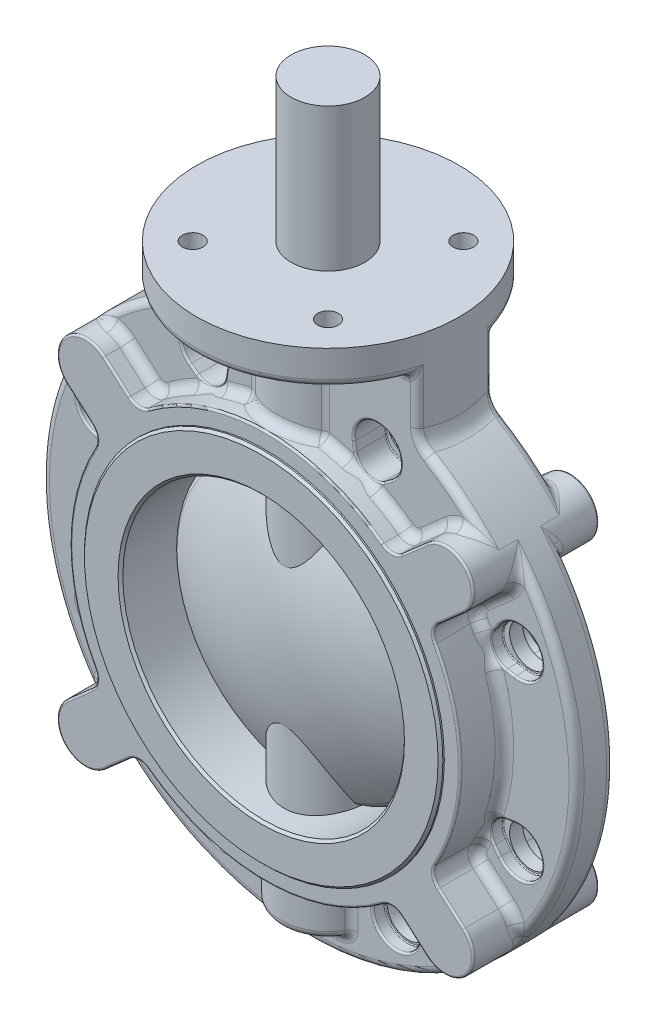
SolidWorks part; units mm, degrees
ref_plane "Front Plane" through (0, 0, 0) normal (0, 0, 1) x (1, 0, 0)
ref_plane "Top Plane" through (0, 0, 0) normal (0, 1, 0) x (1, 0, 0)
ref_plane "Right Plane" through (0, 0, 0) normal (1, 0, 0) x (0, 0, -1)
sketch "Sketch1" plane through (0, 0, 0) normal (0, 0, 1) x (1, 0, 0)
  circle A0 centre (0, 0) radius 142.5
  circle A1 centre (0, 0) radius 92.71
  dimension "D1" = 285
  dimension "D2" = 185.42
extrude "BODY" add sketch "Sketch1" along normal mid plane 67
sketch "Sketch2" plane through (0, 0, 33.5) normal (0, 0, 1) x (1, 0, 0)
  line L0 (0, 0) -> (166.3467, 0) construction
  line L1 (0, 0) -> (126.8644, 111.2571) construction
  line L2 (0, 0) -> (125.9507, -110.4558) construction
  line L3 (0, 0) -> (0, 156.1227) construction
  line L4 (72.5212, 83.5504) -> (85.9694, 95.3442)
  line L5 (105.7498, 72.789) -> (92.3016, 60.9952)
  line L6 (105.7498, -72.789) -> (92.3016, -60.9952)
  line L7 (72.5212, -83.5504) -> (85.9694, -95.3442)
  line L8 (-105.7498, -72.789) -> (-92.3016, -60.9952)
  line L9 (-72.5212, -83.5504) -> (-85.9694, -95.3442)
  line L10 (-105.7498, 72.789) -> (-92.3016, 60.9952)
  line L11 (-72.5212, 83.5504) -> (-85.9694, 95.3442)
  arc A0 (62.4431, 83.1676) -> (-62.4431, 83.1676) centre (0, 0) ccw
  arc A1 (105.7498, 72.789) -> (85.9694, 95.3442) centre (95.8596, 84.0666) ccw
  arc A3 (90.6066, 51.0533) -> (92.3016, 60.9952) centre (97.5763, 54.9805) cw
  arc A4 (72.5212, 83.5504) -> (62.4431, 83.1676) centre (67.2464, 89.5652) cw
  arc A5 (90.6066, -51.0533) -> (92.3016, -60.9952) centre (97.5763, -54.9805) ccw
  arc A6 (105.7498, -72.789) -> (85.9694, -95.3442) centre (95.8596, -84.0666) cw
  arc A7 (72.5212, -83.5504) -> (62.4431, -83.1676) centre (67.2464, -89.5652) ccw
  arc A8 (-90.6066, -51.0533) -> (-92.3016, -60.9952) centre (-97.5763, -54.9805) cw
  arc A9 (-72.5212, -83.5504) -> (-62.4431, -83.1676) centre (-67.2464, -89.5652) cw
  arc A10 (-105.7498, -72.789) -> (-85.9694, -95.3442) centre (-95.8596, -84.0666) ccw
  arc A11 (-90.6066, 51.0533) -> (-92.3016, 60.9952) centre (-97.5763, 54.9805) ccw
  arc A12 (-105.7498, 72.789) -> (-85.9694, 95.3442) centre (-95.8596, 84.0666) cw
  arc A13 (-72.5212, 83.5504) -> (-62.4431, 83.1676) centre (-67.2464, 89.5652) ccw
  arc A14 (-90.6066, 51.0533) -> (-90.6066, -51.0533) centre (0, 0) ccw
  arc A15 (90.6066, -51.0533) -> (90.6066, 51.0533) centre (0, 0) ccw
  arc A16 (-62.4431, -83.1676) -> (62.4431, -83.1676) centre (0, 0) ccw
  dimension "D2" = 208
  dimension "D3" = 30
  dimension "D6" = 8
  dimension "D1" = 82.5
  dimension "D4" = 127.5
  dimension "D5" = 30
extrude "FACE PROFILE SHALLOW" cut sketch "Sketch2" against normal blind 13.5 flip side to cut
sketch "Sketch3" plane through (0, 0, 20) normal (0, 0, 1) x (1, 0, 0)
  line L0 (-105.7498, 72.789) -> (-92.3016, 60.9952) construction
  line L1 (-92.3016, -60.9952) -> (-105.7498, -72.789) construction
  line L2 (92.3016, 60.9952) -> (105.7498, 72.789) construction
  line L3 (105.7498, -72.789) -> (92.3016, -60.9952) construction
  line L4 (72.5212, -83.5504) -> (85.9694, -95.3442) construction
  line L5 (-85.9694, -95.3442) -> (-72.5212, -83.5504) construction
  line L6 (-105.7498, 72.789) -> (-92.3016, 60.9952)
  line L7 (-92.3016, -60.9952) -> (-105.7498, -72.789)
  line L8 (92.3016, 60.9952) -> (105.7498, 72.789)
  line L9 (105.7498, -72.789) -> (92.3016, -60.9952)
  line L10 (72.5212, -83.5504) -> (85.9694, -95.3442)
  line L11 (-85.9694, -95.3442) -> (-72.5212, -83.5504)
  line L12 (-107.1372, 93.9568) -> (-123.1493, 107.999)
  line L13 (107.1372, 93.9568) -> (121.2847, 110.0889)
  arc A1 (-85.9694, 95.3442) -> (-105.7498, 72.789) centre (-95.8596, 84.0666) ccw construction
  arc A2 (-90.6066, 51.0533) -> (-92.3016, 60.9952) centre (-97.5763, 54.9805) ccw construction
  arc A3 (-90.6066, 51.0533) -> (-90.6066, -51.0533) centre (0, 0) ccw construction
  arc A4 (-92.3016, -60.9952) -> (-90.6066, -51.0533) centre (-97.5763, -54.9805) ccw construction
  arc A6 (105.7498, 72.789) -> (85.9694, 95.3442) centre (95.8596, 84.0666) ccw construction
  arc A7 (92.3016, 60.9952) -> (90.6066, 51.0533) centre (97.5763, 54.9805) ccw construction
  arc A8 (90.6066, -51.0533) -> (90.6066, 51.0533) centre (0, 0) ccw construction
  arc A9 (90.6066, -51.0533) -> (92.3016, -60.9952) centre (97.5763, -54.9805) ccw construction
  arc A11 (85.9694, -95.3442) -> (105.7498, -72.789) centre (95.8596, -84.0666) ccw construction
  arc A12 (72.5212, -83.5504) -> (62.4431, -83.1676) centre (67.2464, -89.5652) ccw construction
  arc A13 (-105.7498, -72.789) -> (-85.9694, -95.3442) centre (-95.8596, -84.0666) ccw construction
  arc A14 (-62.4431, -83.1676) -> (-72.5212, -83.5504) centre (-67.2464, -89.5652) ccw construction
  arc A15 (-62.4431, -83.1676) -> (62.4431, -83.1676) centre (0, 0) ccw construction
  arc A16 (-123.1493, 107.999) -> (121.2847, 110.0889) centre (0, 0) ccw
  arc A17 (-107.1372, 93.9568) -> (-105.7498, 72.789) centre (-95.8596, 84.0666) ccw
  arc A18 (-90.6066, 51.0533) -> (-92.3016, 60.9952) centre (-97.5763, 54.9805) ccw
  arc A19 (-90.6066, 51.0533) -> (-90.6066, -51.0533) centre (0, 0) ccw
  arc A20 (-92.3016, -60.9952) -> (-90.6066, -51.0533) centre (-97.5763, -54.9805) ccw
  arc A22 (105.7498, 72.789) -> (107.1372, 93.9568) centre (95.8596, 84.0666) ccw
  arc A23 (92.3016, 60.9952) -> (90.6066, 51.0533) centre (97.5763, 54.9805) ccw
  arc A24 (90.6066, -51.0533) -> (90.6066, 51.0533) centre (0, 0) ccw
  arc A25 (90.6066, -51.0533) -> (92.3016, -60.9952) centre (97.5763, -54.9805) ccw
  arc A27 (85.9694, -95.3442) -> (105.7498, -72.789) centre (95.8596, -84.0666) ccw
  arc A28 (72.5212, -83.5504) -> (62.4431, -83.1676) centre (67.2464, -89.5652) ccw
  arc A29 (-105.7498, -72.789) -> (-85.9694, -95.3442) centre (-95.8596, -84.0666) ccw
  arc A30 (-62.4431, -83.1676) -> (-72.5212, -83.5504) centre (-67.2464, -89.5652) ccw
  arc A31 (-62.4431, -83.1676) -> (62.4431, -83.1676) centre (0, 0) ccw
extrude "FACE PROFILE DEEP" cut sketch "Sketch3" against normal blind 10
mirror "FACE PROFILES Mirror" about plane through (0, 0, 0) normal (0, 0, 1) of "FACE PROFILE SHALLOW", "FACE PROFILE DEEP"
fillet "PROFILE FILLETS EDGE" radius 1 50 edges at (107.1372, -93.9568, -33.5) (-107.1372, -93.9568, -33.5) (-107.1372, 93.9568, -33.5) (107.1372, 93.9568, -33.5) (79.2453, 89.4473, -33.5) (67.5501, 81.5709, -33.5) (0, 104, -33.5) (-67.5501, 81.5709, -33.5) (-79.2453, 89.4473, -33.5) (99.0257, -66.8921, -33.5) (89.6901, -56.325, -33.5) (104, 0, -33.5) (89.6901, 56.325, -33.5) (99.0257, 66.8921, -33.5) (-79.2453, -89.4473, -33.5) (-67.5501, -81.5709, -33.5) (0, -104, -33.5) (67.5501, -81.5709, -33.5) (79.2453, -89.4473, -33.5) (-99.0257, 66.8921, -33.5) (-89.6901, 56.325, -33.5) (-104, 0, -33.5) (-89.6901, -56.325, -33.5) (-99.0257, -66.8921, -33.5) (107.1372, -93.9568, 33.5) (-107.1372, -93.9568, 33.5) (-107.1372, 93.9568, 33.5) (107.1372, 93.9568, 33.5) (104, 0, 33.5) (89.6901, -56.325, 33.5) (99.0257, -66.8921, 33.5) (79.2453, -89.4473, 33.5) (67.5501, -81.5709, 33.5) (0, -104, 33.5) (-67.5501, -81.5709, 33.5) (-79.2453, -89.4473, 33.5) (-99.0257, -66.8921, 33.5) (-89.6901, -56.325, 33.5) (-104, 0, 33.5) (-89.6901, 56.325, 33.5) (-99.0257, 66.8921, 33.5) (-79.2453, 89.4473, 33.5) (-67.5501, 81.5709, 33.5) (0, 104, 33.5) (67.5501, 81.5709, 33.5) (79.2453, 89.4473, 33.5) (99.0257, 66.8921, 33.5) (89.6901, 56.325, 33.5) (92.71, 0, -33.5) (92.71, 0, 33.5)
ref_plane "BOT DIA PLANE" through (0, -130, 0) normal (0, 1, 0) x (-1, 0, 0)
sketch "Sketch4" plane through (0, -130, 0) normal (0, 1, 0) x (-1, 0, 0)
  circle A0 centre (0, 0) radius 25
  dimension "D1" = 50
extrude "BOT DIA" add sketch "Sketch4" along normal up to next
fillet "BOT DIA FILLET LARGE" radius 4 2 edges at (0, -130, -25) (0, -130, 25)
ref_plane "TOP OF VALVE" through (0, 175, 0) normal (0, 1, 0) x (-1, 0, 0)
sketch "Sketch5" plane through (0, 175, 0) normal (0, 1, 0) x (-1, 0, 0)
  circle A0 centre (0, 0) radius 70
  dimension "D1" = 140
extrude "TOP DIA" add sketch "Sketch5" against normal blind 18.5
ref_plane "BOT PLANE VALVE TOP" through (0, 156.5, 0) normal (0, 1, 0) x (-1, 0, 0)
sketch "Sketch6" plane through (0, 156.5, 0) normal (0, 1, 0) x (-1, 0, 0)
  line L0 (107.1372, 20) -> (-107.1372, 20) construction
  line L1 (-107.1372, -20) -> (107.1372, -20) construction
  line L2 (67.082, 20) -> (-67.082, 20)
  line L3 (-67.082, -20) -> (67.082, -20)
  circle A0 centre (0, 0) radius 70 construction
  arc A1 (67.082, -20) -> (67.082, 20) centre (0, 0) ccw
  arc A2 (-67.082, 20) -> (-67.082, -20) centre (0, 0) ccw
extrude "TOP VERT BODY" add sketch "Sketch6" against normal up to surface (30.7771 mm away)
fillet "TOP VERT FILLETS SIDE" radius 10 2 edges at (69.9965, 124.1239, -0.7041) (-69.9965, 124.1239, 0.7041)
fillet "PROFILE FILLETS PERIMETER" radius 4 20 edges at (142.5, 0, 10) (0, -142.5, 10) (-142.5, 0, 10) (69.5859, 125.1073, 20) (90.9059, 109.7377, 20) (-69.3463, 125.4011, 20) (-90.9059, 109.7377, 20) (-69.5859, 125.1073, -20) (69.3463, 125.4011, -20) (-90.9059, 109.7377, -20) (-142.5, 0, -10) (0, -142.5, -10) (142.5, 0, -10) (90.9059, 109.7377, -20)
sketch "Sketch9" plane through (0, 175, 0) normal (0, 1, 0) x (-1, 0, 0)
  line L0 (0, 0) -> (0, -74.4103) construction
  line L1 (0, -6) -> (0, -16) construction
  line L2 (0, 0) -> (-151.174, 0) construction
  line L3 (0, 0) -> (-58.612, -58.612) construction
  circle A0 centre (0, 0) radius 51 construction
  circle A1 centre (-36.0624, -36.0624) radius 5.5
  circle A2 centre (36.0624, -36.0624) radius 5.5
  circle A3 centre (-36.0624, 36.0624) radius 5.5
  circle A4 centre (36.0624, 36.0624) radius 5.5
  dimension "D2" = 102
  dimension "D3" = 11
  dimension "D1" = 45
extrude "TOP DIA 4 THRU HOLES" cut sketch "Sketch9" against normal blind 18.5
sketch "Sketch10" plane through (0, 156.5, 0) normal (0, 1, 0) x (-1, 0, 0)
  circle A0 centre (0, 0) radius 27.5
  dimension "D1" = 55
extrude "TOP VERT DIA" add sketch "Sketch10" against normal up to next
sketch "Sketch11" plane through (0, 0, 0) normal (1, 0, 0) x (0, 0, -1)
  line L1 (-66, 156.5) -> (-20, 156.5) construction
  line L2 (-20.5085, 141.5) -> (-20.5085, 156.5)
  line L3 (-50, 156.5) -> (-20.5085, 156.5)
  line L4 (-50, 156.5) -> (-20.5085, 141.5)
  line L5 (0, 114.9675) -> (0, 155.7847) construction
  dimension "D1" = 50
  dimension "D2" = 15
extrude "TOP GUSSET" add sketch "Sketch11" along normal mid plane 14
mirror "TOP GUSSET Mirror" about plane through (0, 0, 0) normal (0, 0, 1) of "TOP GUSSET"
sketch "Sketch14" plane through (0, 0, 0) normal (0, 0, 1) x (1, 0, 0)
  line L0 (0, 0) -> (-155.764, 0) construction
  line L1 (0, 0) -> (0, 187.0979) construction
  line L2 (0, 0) -> (-141.1825, 58.4797) construction
  circle A0 centre (-111.4661, 46.1708) radius 11.176
  circle A1 centre (0, 0) radius 120.65 construction
  circle A2 centre (-46.1708, 111.4661) radius 11.176
  circle A3 centre (46.1708, 111.4661) radius 11.176
  circle A4 centre (111.4661, 46.1708) radius 11.176
  circle A5 centre (111.4661, -46.1708) radius 11.176
  circle A6 centre (46.1708, -111.4661) radius 11.176
  circle A7 centre (-46.1708, -111.4661) radius 11.176
  circle A8 centre (-111.4661, -46.1708) radius 11.176
  dimension "D3" = 241.3
  dimension "D2" = 22.352
  dimension "D1" = 22.5
extrude "THRU HOLE FOR LUGS" cut sketch "Sketch14" against normal through all and the other way through all
sketch "Sketch15" plane through (0, 0, 20) normal (0, 0, 1) x (1, 0, 0)
  line L0 (-46.1708, 111.4661) -> (0, 0) construction
  line L1 (-53.5653, 101.4523) -> (-49.5994, 98.5655)
  line L2 (53.5653, 101.4523) -> (49.5994, 98.5655)
  line L3 (-33.8612, 109.614) -> (-34.6242, 104.7684)
  line L4 (33.8612, 109.614) -> (34.6242, 104.7684)
  line L5 (109.614, 33.8612) -> (104.7684, 34.6242)
  line L6 (101.4523, 53.5653) -> (98.5655, 49.5994)
  line L7 (101.4523, -53.5653) -> (98.5655, -49.5994)
  line L8 (109.614, -33.8612) -> (104.7684, -34.6242)
  line L9 (33.8612, -109.614) -> (34.6242, -104.7684)
  line L10 (53.5653, -101.4523) -> (49.5994, -98.5655)
  line L11 (-53.5653, -101.4523) -> (-49.5994, -98.5655)
  line L12 (-33.8612, -109.614) -> (-34.6242, -104.7684)
  line L13 (-109.614, -33.8612) -> (-104.7684, -34.6242)
  line L14 (-101.4523, -53.5653) -> (-98.5655, -49.5994)
  line L15 (-101.4523, 53.5653) -> (-98.5655, 49.5994)
  line L16 (-109.614, 33.8612) -> (-104.7684, 34.6242)
  line L17 (0, 0) -> (-215.4838, 0) construction
  arc A1 (-33.8612, 109.614) -> (-53.5653, 101.4523) centre (-46.209, 111.5585) ccw
  arc A2 (-49.5994, 98.5655) -> (-34.6242, 104.7684) centre (-44.0086, 106.2461) ccw
  arc A3 (53.5653, 101.4523) -> (33.8612, 109.614) centre (46.209, 111.5585) ccw
  arc A4 (34.6242, 104.7684) -> (49.5994, 98.5655) centre (44.0086, 106.2461) ccw
  arc A5 (109.614, 33.8612) -> (101.4523, 53.5653) centre (111.5585, 46.209) ccw
  arc A6 (98.5655, 49.5994) -> (104.7684, 34.6242) centre (106.2461, 44.0086) ccw
  arc A7 (101.4523, -53.5653) -> (109.614, -33.8612) centre (111.5585, -46.209) ccw
  arc A8 (104.7684, -34.6242) -> (98.5655, -49.5994) centre (106.2461, -44.0086) ccw
  arc A9 (33.8612, -109.614) -> (53.5653, -101.4523) centre (46.209, -111.5585) ccw
  arc A10 (49.5994, -98.5655) -> (34.6242, -104.7684) centre (44.0086, -106.2461) ccw
  arc A11 (-53.5653, -101.4523) -> (-33.8612, -109.614) centre (-46.209, -111.5585) ccw
  arc A12 (-34.6242, -104.7684) -> (-49.5994, -98.5655) centre (-44.0086, -106.2461) ccw
  arc A13 (-109.614, -33.8612) -> (-101.4523, -53.5653) centre (-111.5585, -46.209) ccw
  arc A14 (-98.5655, -49.5994) -> (-104.7684, -34.6242) centre (-106.2461, -44.0086) ccw
  arc A15 (-101.4523, 53.5653) -> (-109.614, 33.8612) centre (-111.5585, 46.209) ccw
  arc A16 (-104.7684, 34.6242) -> (-98.5655, 49.5994) centre (-106.2461, 44.0086) ccw
  dimension "D1" = 25
  dimension "D3" = 19
  dimension "D2" = 120.75
  dimension "D4" = 115
extrude "LUG INSERTS PROFILE" cut sketch "Sketch15" against normal blind 16.5
mirror "LUG INSERTS PROFILE Mirror" about plane through (0, 0, 0) normal (0, 0, 1) of "LUG INSERTS PROFILE"
fillet "LUG INSERTS PROFILE FILLETS" radius 1 64 edges at (-34.2427, 107.1912, 20) (-50.9926, 123.1069, 20) (-51.5824, 100.0089, 20) (-40.3731, 97.4693, 20) (-100.0089, 51.5824, 10) (-97.4693, 40.3731, 10) (-107.1912, 34.2427, 10) (-107.1912, -34.2427, 10) (-97.4693, -40.3731, 10) (-100.0089, -51.5824, 10) (-51.5824, -100.0089, 10) (-40.3731, -97.4693, 10) (-34.2427, -107.1912, 10) (50.9926, -123.1069, 10) (34.2427, -107.1912, 10) (40.3731, -97.4693, 10) (107.1912, -34.2427, 10) (123.1069, -50.9926, 10) (100.0089, -51.5824, 10) (100.0089, 51.5824, 10) (123.1069, 50.9926, 10) (107.1912, 34.2427, 10) (51.5824, 100.0089, 20) (40.3731, 97.4693, 20) (-123.1069, 50.9926, 10) (-123.1069, -50.9926, 10) (-50.9926, -123.1069, 10) (51.5824, -100.0089, 10) (97.4693, -40.3731, 10) (97.4693, 40.3731, 10) (50.9926, 123.1069, 20) (34.2427, 107.1912, 20) (107.1912, 34.2427, -10) (97.4693, 40.3731, -10) (100.0089, 51.5824, -10) (123.1069, 50.9926, -10) (51.5824, 100.0089, -20) (40.3731, 97.4693, -20) (34.2427, 107.1912, -20) (50.9926, 123.1069, -20) (-51.5824, 100.0089, -20) (-50.9926, 123.1069, -20) (-34.2427, 107.1912, -20) (-40.3731, 97.4693, -20) (-107.1912, -34.2427, -10) (-97.4693, -40.3731, -10) (-100.0089, -51.5824, -10) (-100.0089, 51.5824, -10) (-97.4693, 40.3731, -10) (-107.1912, 34.2427, -10) (-123.1069, -50.9926, -10) (-123.1069, 50.9926, -10) (-51.5824, -100.0089, -10) (-40.3731, -97.4693, -10) (-34.2427, -107.1912, -10) (34.2427, -107.1912, -10) (40.3731, -97.4693, -10) (51.5824, -100.0089, -10) (100.0089, -51.5824, -10) (97.4693, -40.3731, -10) (107.1912, -34.2427, -10) (-50.9926, -123.1069, -10) (50.9926, -123.1069, -10) (123.1069, -50.9926, -10)
fillet "PROFILE FILLETS LARGE" radius 5 106 edges at (-91.0283, -98.2673, 10) (109.3081, -77.4231, 10) (-109.3081, 77.4231, 10) (-99.0257, 66.8921, 10) (-89.6901, 56.325, 10) (-104, 0, 10) (-89.6901, -56.325, 10) (-99.0257, -66.8921, 10) (-110.0668, -88.8785, 10) (-79.2453, -89.4473, 10) (-67.5501, -81.5709, 10) (43.6454, -94.3985, 10) (67.5501, -81.5709, 10) (79.2453, -89.4473, 10) (102.4847, -97.5242, 10) (99.0257, -66.8921, 10) (89.6901, -56.325, 10) (104, 0, 10) (89.6901, 56.325, 10) (99.0257, 66.8921, 10) (-91.0283, 98.2673, -20) (79.2453, 89.4473, -20) (67.5501, 81.5709, -20) (41.766, 95.245, -20) (-67.5501, 81.5709, -20) (-79.2453, 89.4473, -20) (99.0257, 66.8921, -10) (89.6901, 56.325, -10) (79.2453, 89.4473, 20) (104, 0, -10) (89.6901, -56.325, -10) (99.0257, -66.8921, -10) (109.3081, -77.4231, -10) (102.4847, -97.5242, -10) (79.2453, -89.4473, -10) (67.5501, -81.5709, -10) (43.6454, -94.3985, -10) (-67.5501, -81.5709, -10) (-79.2453, -89.4473, -10) (67.5501, 81.5709, 20) (-91.0283, -98.2673, -10) (-110.0668, -88.8785, -10) (-99.0257, -66.8921, -10) (-89.6901, -56.325, -10) (-104, 0, -10) (-89.6901, 56.325, -10) (-99.0257, 66.8921, -10) (-109.3081, 77.4231, -10) (41.766, 95.245, 20) (-67.5501, 81.5709, 20) (-79.2453, 89.4473, 20) (-91.0283, 98.2673, 20) (-43.6454, -94.3985, -10) (-3.3247, -103.9468, 24.7779) (22.9129, -113.7223, -10) (-43.6454, -94.3985, 10) (3.3247, -103.9468, 24.7779) (-22.9129, -113.7223, 10) (-22.9129, -113.7223, -10) (0, -130, -10) (22.9129, -113.7223, 10) (0, -130, 10) (-22.089, -128.3358, -10) (21.5291, -128.9159, -10) (22.089, -128.3358, 10) (-21.5291, -128.9159, 10) (91.0283, 98.2673, -20) (-109.3081, -77.4231, -10) (91.0283, -98.2673, -10) (-102.4847, -97.5242, -10) (110.0668, -88.8785, -10) (109.3081, 77.4231, -10) (91.0283, 98.2673, 20) (109.3081, 77.4231, 10) (110.0668, -88.8785, 10) (-102.4847, -97.5242, 10) (91.0283, -98.2673, 10) (-109.3081, -77.4231, 10) (-99.8351, 98.5302, -19.5878) (-110.7183, 86.1202, -9.5878) (110.7183, 86.1202, -9.5878) (99.8351, 98.5302, -19.5878) (99.8351, 98.5302, 19.5878) (110.7183, 86.1202, 9.5878) (-99.8351, 98.5302, 19.5878) (-110.7183, 86.1202, 9.5878) (66.4373, 158.0408, -19.1954) (-66.4373, 158.0408, -19.1954) (-66.4373, 158.0408, 19.1954) (66.4373, 158.0408, 19.1954) (-41.766, 95.245, 20) (-3.8179, 103.9299, -27.2337) (18.8746, 129.3865, 20) (-18.8746, 129.3865, 20) (-41.766, 95.245, -20) (-18.8746, 129.3865, -20) (18.8746, 129.3865, -20) (3.8179, 103.9299, -27.2337)
fillet "TOP GUSSET FILLETS" radius 1 16 edges at (-7, 156.5, 38.2971) (-7, 150.5477, 38.2971) (-7, 150.5477, 26.5942) (7, 156.5, 38.2971) (7, 150.5477, 26.5942) (7, 150.5477, 38.2971) (0, 156.5, 50) (0, 145.056, 27.5) (-7, 150.5477, -38.2971) (-7, 156.5, -38.2971) (-7, 150.5477, -26.5942) (7, 150.5477, -38.2971) (7, 150.5477, -26.5942) (7, 156.5, -38.2971) (0, 156.5, -50) (0, 145.056, -27.5)
fillet "Fillet1" radius 0.5 64 edges at (100.0089, 51.5824, 3.5) (123.1069, 50.9926, 3.5) (107.1912, 34.2427, 3.5) (97.4693, 40.3731, 3.5) (107.1912, -34.2427, 3.5) (123.1069, -50.9926, 3.5) (100.0089, -51.5824, 3.5) (34.2427, -107.1912, 3.5) (40.3731, -97.4693, 3.5) (51.5824, -100.0089, 3.5) (-51.5824, -100.0089, 3.5) (-40.3731, -97.4693, 3.5) (-34.2427, -107.1912, 3.5) (-107.1912, -34.2427, 3.5) (-97.4693, -40.3731, 3.5) (-100.0089, -51.5824, 3.5) (-100.0089, 51.5824, 3.5) (-97.4693, 40.3731, 3.5) (-107.1912, 34.2427, 3.5) (34.2427, 107.1912, 3.5) (50.9926, 123.1069, 3.5) (51.5824, 100.0089, 3.5) (-51.5824, 100.0089, 3.5) (-50.9926, 123.1069, 3.5) (-34.2427, 107.1912, 3.5) (97.4693, -40.3731, 3.5) (50.9926, -123.1069, 3.5) (-50.9926, -123.1069, 3.5) (-123.1069, -50.9926, 3.5) (-123.1069, 50.9926, 3.5) (40.3731, 97.4693, 3.5) (-40.3731, 97.4693, 3.5) (-107.1912, 34.2427, -3.5) (-123.1069, 50.9926, -3.5) (-100.0089, 51.5824, -3.5) (-34.2427, 107.1912, -3.5) (-40.3731, 97.4693, -3.5) (-51.5824, 100.0089, -3.5) (-100.0089, -51.5824, -3.5) (-123.1069, -50.9926, -3.5) (-107.1912, -34.2427, -3.5) (-34.2427, -107.1912, -3.5) (-50.9926, -123.1069, -3.5) (-51.5824, -100.0089, -3.5) (51.5824, -100.0089, -3.5) (50.9926, -123.1069, -3.5) (34.2427, -107.1912, -3.5) (51.5824, 100.0089, -3.5) (40.3731, 97.4693, -3.5) (34.2427, 107.1912, -3.5) (100.0089, -51.5824, -3.5) (97.4693, -40.3731, -3.5) (107.1912, -34.2427, -3.5) (107.1912, 34.2427, -3.5) (97.4693, 40.3731, -3.5) (100.0089, 51.5824, -3.5) (-97.4693, 40.3731, -3.5) (-50.9926, 123.1069, -3.5) (-97.4693, -40.3731, -3.5) (-40.3731, -97.4693, -3.5) (40.3731, -97.4693, -3.5) (50.9926, 123.1069, -3.5) (123.1069, -50.9926, -3.5) (123.1069, 50.9926, -3.5)
sketch "Sketch16" plane through (0, 0, 0) normal (0, 0, 1) x (1, 0, 0)
  circle A0 centre (0, 0) radius 95.504
  circle A1 centre (0, 0) radius 75.057
  dimension "D1" = 191.008
  dimension "D2" = 150.114
extrude "Extrude1" add sketch "Sketch16" along normal mid plane 71.12
chamfer "Chamfer1" distance 1.27 angle 45 4 edges at (75.057, 0, 35.56) (95.504, 0, 35.56) (75.057, 0, -35.56) (95.504, 0, -35.56)
sketch "Sketch17" plane through (0, 0, 0) normal (0, 1, 0) x (1, 0, 0)
  line L0 (0, 0) -> (0, -55.7565) construction
  line L1 (0, 0) -> (0, 54.1783) construction
  line L2 (0, 0) -> (76.1763, 0) construction
  line L3 (75.057, -21.8061) -> (75.057, 23.3143) construction
  line L4 (0, -28.3568) -> (0, 28.3568)
  line L5 (75.057, -3.1419) -> (75.057, 3.1419)
  arc A0 (0, -28.3568) -> (72.156, -8.2795) centre (0, 111.3432) ccw
  arc A1 (0, 28.3568) -> (72.156, 8.2795) centre (0, -111.3432) cw
  arc A2 (72.156, -8.2795) -> (75.057, -3.1419) centre (69.057, -3.1419) ccw
  arc A3 (75.057, 3.1419) -> (72.156, 8.2795) centre (69.057, 3.1419) ccw
  point P15 (75.057, -6.481)
  point P18 (75.057, 6.481)
  dimension "D2" = 279.4
  dimension "D3" = 6
  dimension "D1" = 75.057
revolve "Revolve1" add sketch "Sketch17" angle 360 about L0
sketch "Sketch18" plane through (0, 0, 0) normal (0, 1, 0) x (1, 0, 0)
  circle A0 centre (0, 0) radius 23.4368
extrude "Extrude2" add sketch "Sketch18" along normal up to next and the other way up to next
sketch "Sketch19" plane through (0, 175, 0) normal (0, 1, 0) x (1, 0, 0)
  circle A0 centre (0, 0) radius 19.6254
extrude "Extrude3" add sketch "Sketch19" along normal blind 76.2
